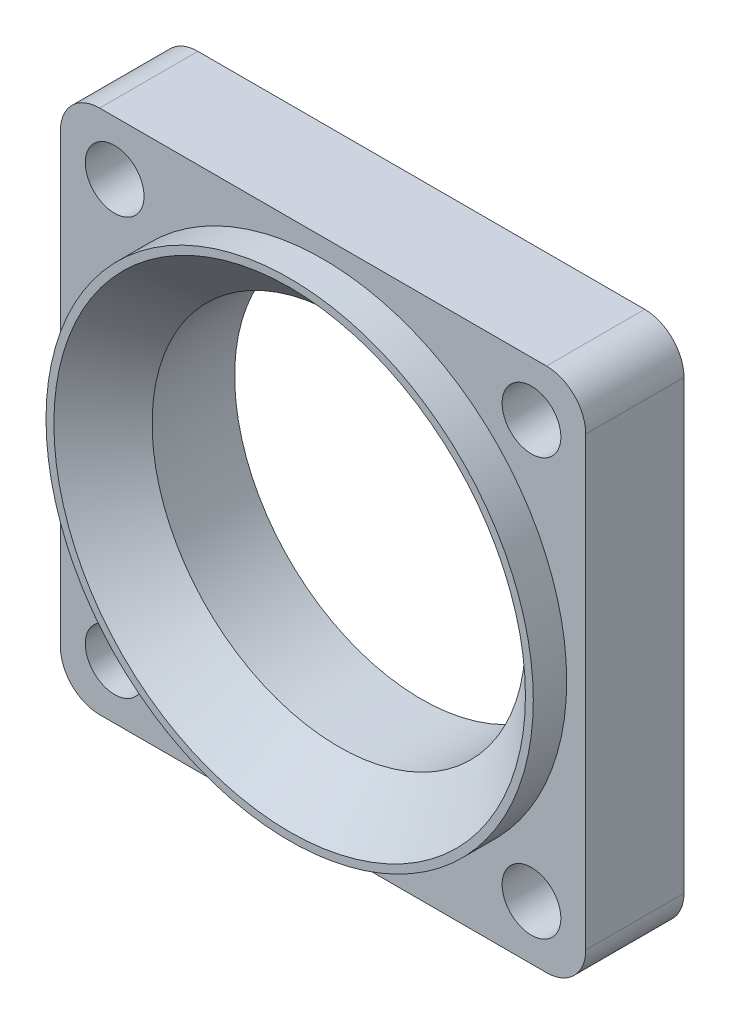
SolidWorks part; units mm, degrees
ref_plane "Front" through (0, 0, 0) normal (0, 0, 1) x (1, 0, 0)
ref_plane "Top" through (0, 0, 0) normal (0, 1, 0) x (1, 0, 0)
ref_plane "Right" through (0, 0, 0) normal (1, 0, 0) x (0, 0, -1)
sketch "Sketch2" plane through (0, 0, 0) normal (1, 0, 0) x (0, 0, -1)
  line L0 (-0.1458, 0) -> (51.1675, 0) construction
  line L1 (0, 15.748) -> (0, 16.9785)
  line L2 (0, 16.9785) -> (6.35, 16.9785)
  line L3 (6.35, 16.9785) -> (6.35, 12.065)
  line L6 (1.016, 12.065) -> (-2.159, 15.24)
  line L7 (-2.159, 15.748) -> (0, 15.748)
  line L8 (1.016, 12.065) -> (6.35, 12.065)
  line L9 (-2.159, 15.748) -> (-2.159, 15.24)
  dimension "D1" = 31.496
  dimension "D2" = 33.957
  dimension "D3" = 45
  dimension "D4" = 24.13
  dimension "D5" = 6.35
  dimension "D6" = 1.016
  dimension "D7" = 30.48
revolve "Revolve1" add sketch "Sketch2" angle 360 about L0
sketch "Sketch3" plane through (0, 0, 0) normal (0, 0, 1) x (1, 0, 0)
  line L1 (-16.9785, 16.9785) -> (16.9785, 16.9785)
  line L2 (-16.9785, 16.9785) -> (-16.9785, -16.9785)
  line L3 (-16.9785, -16.9785) -> (16.9785, -16.9785)
  line L4 (16.9785, 16.9785) -> (16.9785, -16.9785)
  circle A0 centre (0, 0) radius 15.748
  point P4 (16.9785, 0)
  point P6 (0, 16.9785)
extrude "Boss-Extrude1" add sketch "Sketch3" against normal up to vertex (6.35 mm away)
sketch "Sketch4" plane through (0, 0, -6.35) normal (0, 0, -1) x (-1, 0, 0)
  line L1 (-13.4704, 13.4704) -> (13.4704, 13.4704) construction
  line L2 (-13.4704, 13.4704) -> (-13.4704, -13.4704) construction
  line L3 (-13.4704, -13.4704) -> (13.4704, -13.4704) construction
  line L4 (13.4704, 13.4704) -> (13.4704, -13.4704) construction
  circle A0 centre (0, 0) radius 19.05 construction
  point P0 (-13.4704, 13.4704)
  point P2 (13.4704, 13.4704)
  point P4 (13.4704, -13.4704)
  point P6 (-13.4704, -13.4704)
  dimension "D1" = 38.1
hole_wizard "#6 Clearance Hole1" positions "Sketch4" profile "Sketch5" hole size "#6" standard "ANSI Inch"
sketch "Sketch5" plane through (13.4704, 13.4704, -6.35) normal (1, 0, 0) x (0, 1, 0)
  line L0 (0, 0) -> (0, 8.509)
  line L1 (0, 8.509) -> (1.8986, 8.509)
  line L2 (1.8986, 8.509) -> (1.8986, 0)
  line L5 (1.8986, 0) -> (0, 0)
  line L11 (0, -6.35) -> (0, 107.95) construction
  dimension "Thru Hole Dia." = 3.7973
  dimension "Thru Hole Depth" = 8.509
fillet "Fillet1" radius 2.54 4 edges at (-16.9785, 16.9785, -3.175) (-16.9785, -16.9785, -3.175) (16.9785, -16.9785, -3.175) (16.9785, 16.9785, -3.175)
